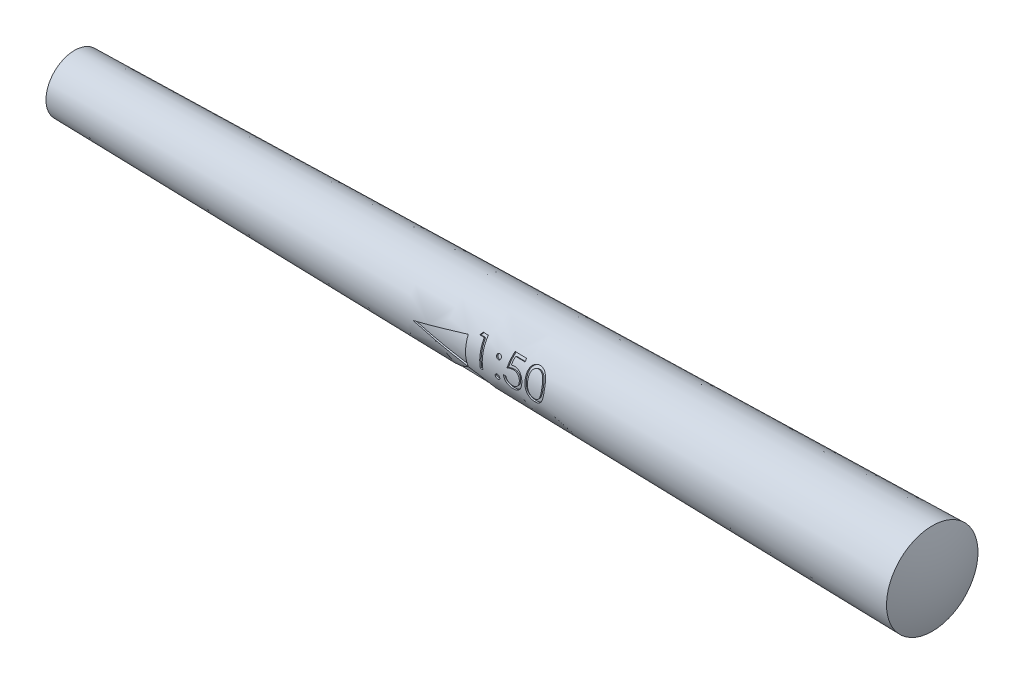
SolidWorks part; units mm, degrees
ref_plane "Front Plane" through (0, 0, 0) normal (0, 0, 1) x (1, 0, 0)
ref_plane "Top Plane" through (0, 0, 0) normal (0, 1, 0) x (1, 0, 0)
ref_plane "Right Plane" through (0, 0, 0) normal (1, 0, 0) x (0, 0, -1)
sketch "Sketch1" plane through (0, 0, 0) normal (1, 0, 0) x (0, 0, -1)
  circle A0 centre (0, 0) radius 1
  dimension "D1" = 2
extrude "Extrude1" add sketch "Sketch1" along normal mid plane 30
draft "Draft1" type of draft neutral plane draft angle 1.146 faces to draft 1 parameters "D1"=1.146
sketch "Sketch2" plane through (0, 0, 0) normal (0, 0, 1) x (1, 0, 0)
  line L0 (-15, 0) -> (-15, 1)
  line L1 (-15, 1) -> (-15, -1) construction
  line L2 (-15, 0) -> (-15.3, 0)
  line L3 (-15.3, 0) -> (-15.3, -1.3) construction
  line L4 (15, 0) -> (15, 1.6)
  line L5 (15, -1.6) -> (15, 1.6) construction
  line L6 (15, 0) -> (15.3, 0)
  line L7 (15.3, 0) -> (15.3, -1.3) construction
  line L8 (-15, -1) -> (15, -1.6) construction
  arc A0 (-15.3, 0) -> (-15, 1) centre (-13.4833, 0) cw
  arc A1 (15.3, 0) -> (15, 1.6) centre (10.8832, 0) ccw
  point P14 (0, -1.3)
revolve "Revolve1" add sketch "Sketch2" angle 360 about L2
sketch "Sketch5" plane through (0, 0, 0) normal (0, 0, 1) x (1, 0, 0)
  line L0 (0, 1.3) -> (0, -1.3) construction
  line L1 (15, 1.6) -> (-15, 1) construction
  line L2 (-15, -1) -> (15, -1.6) construction
ref_plane "Plane2" through (0, 0, 0) normal (-0.02, 0, 0.9998) x (0.9998, 0, 0.02)
sketch "Sketch6" plane through (0, 0, 0) normal (-0.02, 0, 0.9998) x (0.9998, 0, 0.02)
  line L0 (0, 0) -> (0, 0.5)
  line L1 (0, 1.3) -> (0, -1.3) construction
  line L2 (0, 0.5) -> (-1.866, 0)
  line L3 (-1.866, 0) -> (0, -0.5)
  line L4 (0, -0.5) -> (0, 0)
  line L5 (0, -0.25) -> (3, -0.25) construction
  text T0 "1:50" font "Century Gothic" height 1
  dimension "D1" = 1
  dimension "D2" = 30
  dimension "D3" = 3
wrap "Wrap2" sketch "Sketch6" wrap type deboss source sketch "Sketch6" thickness 0.05 parameters "D1"=0.05
equation "\"D2@Sketch2\" = \"D1@Sketch2\""
